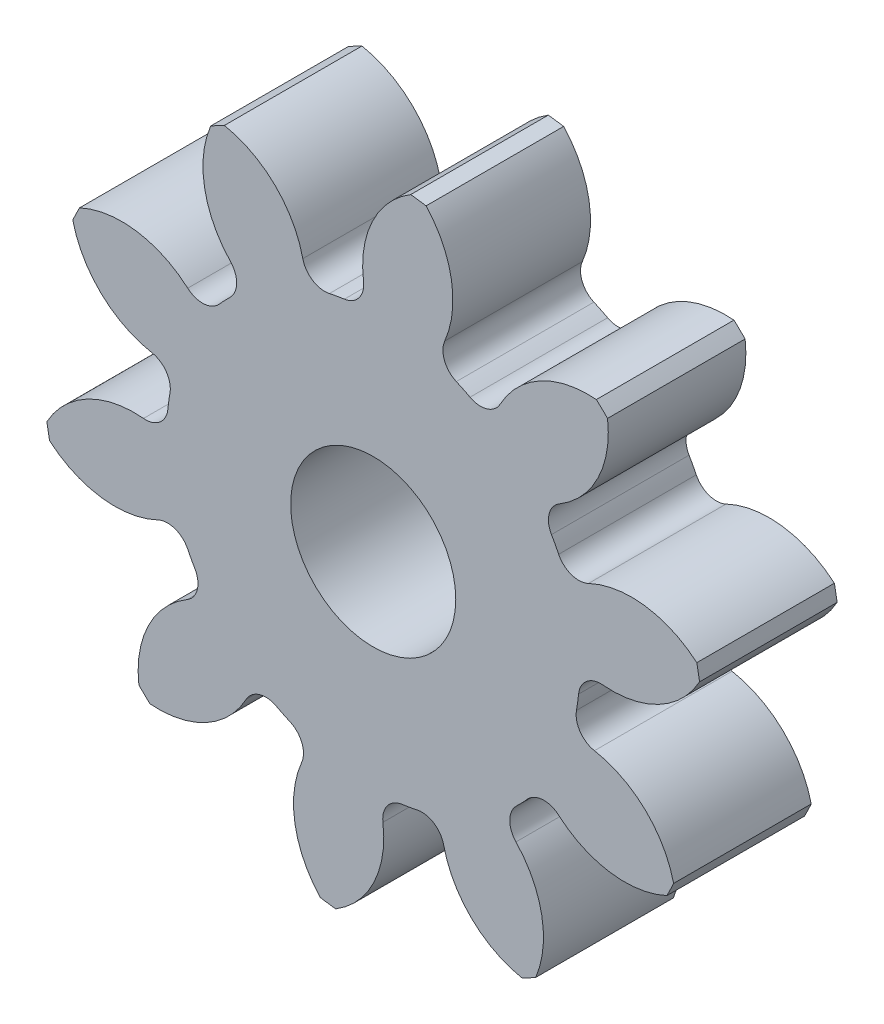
SolidWorks part; units mm, degrees
ref_plane "Front" through (0, 0, 0) normal (0, 0, 1) x (1, 0, 0)
ref_plane "Top" through (0, 0, 0) normal (0, 1, 0) x (1, 0, 0)
ref_plane "Right" through (0, 0, 0) normal (1, 0, 0) x (0, 0, -1)
sketch "Sketch3" plane through (0, 0, 0) normal (0, 0, 1) x (1, 0, 0)
  circle A0 centre (0, 0) radius 304.8
  dimension "od" = 609.6
extrude "gearBody" add sketch "Sketch3" along normal blind 127
sketch "Sketch2" plane through (0, 0, 0) normal (0, 0, 1) x (1, 0, 0)
  line L0 (0, 0) -> (220.5133, 91.3396) construction
  line L1 (278.8143, -134.3707) -> (0, 0) construction
  line L2 (0, 0) -> (36.3143, 0) construction
  line L3 (253.9442, 5.322) -> (242.9928, -73.9627) construction
  line L5 (248.4685, -34.3204) -> (0, 0) construction
  line L7 (0, 0) -> (238.6819, 0) construction
  arc A0 (238.6804, 0.8597) -> (229.5102, -65.5297) centre (0, 0) ccw construction
  arc A1 (301.2194, 46.5826) -> (277.3127, -126.4938) centre (0, 0) ccw construction
  arc A2 (253.9442, 5.322) -> (242.9928, -73.9627) centre (0, 0) ccw construction
  arc A3 (187.6158, -33.0239) -> (189.5429, -19.0721) centre (0, 0) ccw
  arc A4 (278.8143, -134.3707) -> (204.2294, -56.941) centre (187.4958, -147.6969) ccw
  arc A5 (278.8143, -134.3707) -> (304.8, 53.7575) centre (0, 0) ccw
  arc A6 (304.8, 53.7575) -> (212.0179, -0.5542) centre (220.5133, 91.3396) cw
  arc A7 (189.5429, -19.0721) -> (212.0179, -0.5542) centre (210.1146, -21.1421) cw
  arc A8 (204.2294, -56.941) -> (187.6158, -33.0239) centre (207.9783, -36.6081) cw
  point P6 (304.8, 53.7575)
  point P22 (278.8143, -134.3707)
  dimension "baseDia" = 477.3639
  dimension "od" = 609.6
  dimension "pd" = 508
  dimension "rd" = 381
  dimension "rFillet" = 20.6756
  dimension "pointX" = 304.8
  dimension "pointY" = 53.7575
  dimension "CTT" = 79.2847
  dimension "flankCenterAngle" = 22.5
extrude "toothCut" cut sketch "Sketch2" along normal through all
pattern_circular "CirPattern1" count 10 over 360 about axis through (0, 0, 0) along (0, 0, 1) of "toothCut"
sketch "hub1Dia" plane through (0, 0, 0) normal (0, 0, -1) x (-1, 0, 0)
  circle A0 centre (0, 0) radius 12.7
  dimension "hub1Dia" = 25.4
sketch "hub2Dia" plane through (0, 0, 127) normal (0, 0, 1) x (1, 0, 0)
  circle A0 centre (0, 0) radius 12.7
  dimension "hub2dia" = 25.4
sketch "boreDia" plane through (0, 0, 0) normal (0, 0, 1) x (1, 0, 0)
  circle A0 centre (0, 0) radius 76.2
  dimension "boreDia" = 152.4
extrude "bore" cut sketch "boreDia" against normal mid plane 25400
